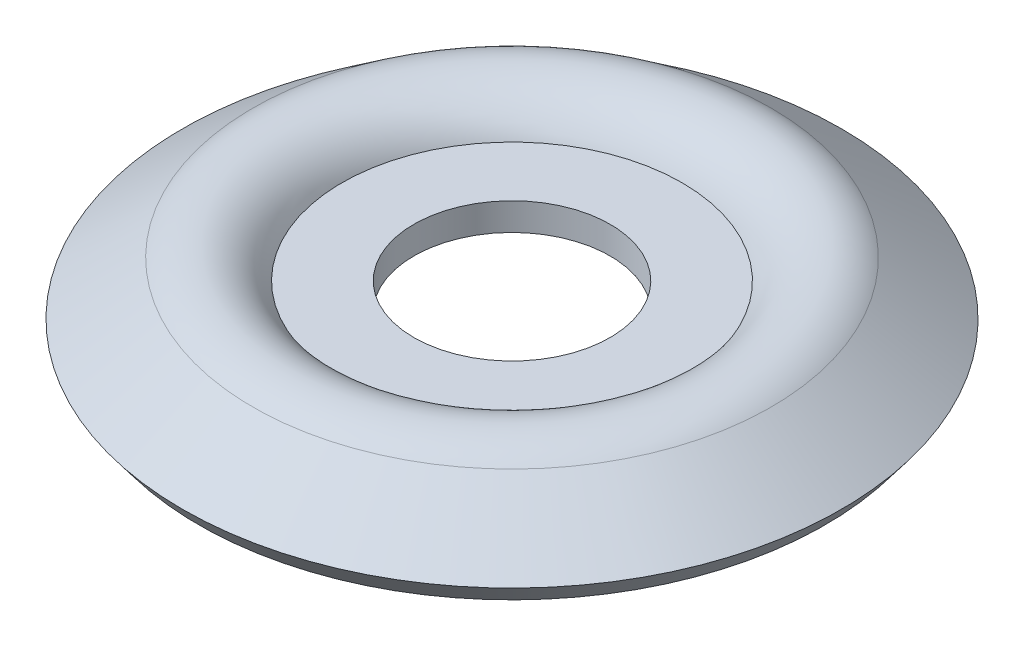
SolidWorks part; units mm, degrees
ref_plane "Front" through (0, 0, 0) normal (0, 0, 1) x (1, 0, 0)
ref_plane "Top" through (0, 0, 0) normal (0, 1, 0) x (1, 0, 0)
ref_plane "Right" through (0, 0, 0) normal (1, 0, 0) x (0, 0, -1)
sketch "Sketch1" plane through (0, 0, 0) normal (0, 0, 1) x (1, 0, 0)
  line L0 (0, 0) -> (17.653, 0)
  line L1 (0, 0) -> (0, 5.9432) construction
  line L2 (22.4356, 2.382) -> (28.956, -2.54)
  arc A0 (22.4356, 2.382) -> (17.653, 0) centre (20.6375, 0) ccw
  dimension "D2" = 5.969
  dimension "D1" = 20.6375
  dimension "D3" = 28.956
  dimension "D4" = 2.54
revolve "Revolve-Thin1" add sketch "Sketch1" angle 360 about L1
sketch "Sketch2" plane through (0, 2.54, 0) normal (0, 1, 0) x (-1, 0, 0)
  circle A0 centre (0, 0) radius 9.0805
  dimension "D1" = 18.161
extrude "Cut-Extrude1" cut sketch "Sketch2" against normal through all
